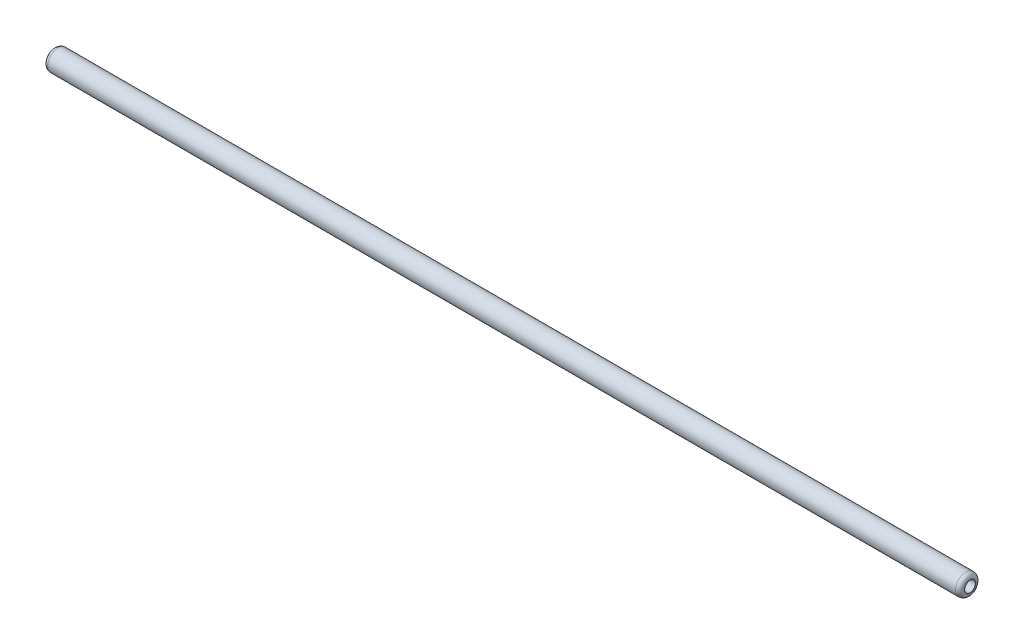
SolidWorks part; units mm, degrees
ref_plane "Front Plane" through (0, 0, 0) normal (0, 0, 1) x (1, 0, 0)
ref_plane "Top Plane" through (0, 0, 0) normal (0, 1, 0) x (1, 0, 0)
ref_plane "Right Plane" through (0, 0, 0) normal (1, 0, 0) x (0, 0, -1)
sketch "Sketch1" plane through (0, 0, 0) normal (1, 0, 0) x (0, 0, -1)
  circle A0 centre (0, 0) radius 6.35
  dimension "D1" = 12.7
extrude "Boss-Extrude1" add sketch "Sketch1" along normal blind 558.8
hole_wizard "5/16-18 Tapped Hole1" positions "Sketch2" profile "Sketch3" tap size "5/16-18" standard "ANSI Inch"
sketch "Sketch2" plane through (0, 0, 0) normal (-1, 0, 0) x (0, 0, 1)
  point P0 (0, 0)
sketch "Sketch3" plane through (0, 0, 0) normal (0, 1, 0) x (0, 0, 1)
  line L0 (0, 0) -> (0, 33.7111)
  line L1 (0, 33.7111) -> (3.2639, 31.75)
  line L2 (3.2639, 31.75) -> (3.2639, 0)
  line L5 (3.2639, 0) -> (0, 0)
  line L10 (0, 33.7111) -> (-3.2639, 31.75) construction
  line L11 (0, -6.35) -> (0, 107.95) construction
  dimension "Tap Drill Dia." = 6.5278
  dimension "Tap Drill Depth" = 31.75
  dimension "Drill Angle" = 118
fillet "Fillet1" radius 2.54 2 edges at (558.8, 0, -6.35) (0, 0, -6.35)
hole_wizard "5/16-18 Tapped Hole2" positions "Sketch4" profile "Sketch5" tap size "5/16-18" standard "ANSI Inch"
sketch "Sketch4" plane through (558.8, 0, 0) normal (1, 0, 0) x (0, 0, -1)
  point P0 (0, 0)
sketch "Sketch5" plane through (558.8, 0, 0) normal (0, 1, 0) x (0, 0, -1)
  line L0 (0, 0) -> (0, 33.7111)
  line L1 (0, 33.7111) -> (3.2639, 31.75)
  line L2 (3.2639, 31.75) -> (3.2639, 0)
  line L5 (3.2639, 0) -> (0, 0)
  line L10 (0, 33.7111) -> (-3.2639, 31.75) construction
  line L11 (0, -6.35) -> (0, 107.95) construction
  dimension "Tap Drill Dia." = 6.5278
  dimension "Tap Drill Depth" = 31.75
  dimension "Drill Angle" = 118
